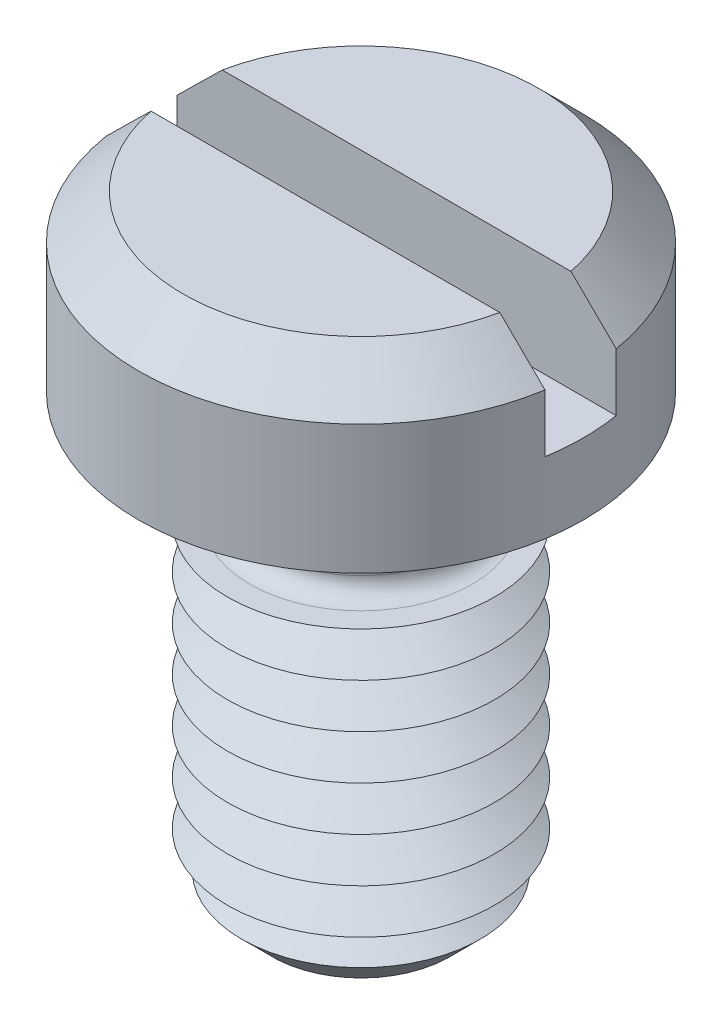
SolidWorks part; units mm, degrees
ref_plane "Front Plane" through (0, 0, 0) normal (0, 0, 1) x (1, 0, 0)
ref_plane "Top Plane" through (0, 0, 0) normal (0, 1, 0) x (1, 0, 0)
ref_plane "Right Plane" through (0, 0, 0) normal (1, 0, 0) x (0, 0, -1)
sketch "Sketch1" plane through (0, 0, 0) normal (0, 1, 0) x (1, 0, 0)
  circle A0 centre (0, 0) radius 5
  dimension "D1" = 10
extrude "Boss-Extrude1" add sketch "Sketch1" along normal blind 3.9
sketch "Sketch2" plane through (0, 0, 0) normal (0, -1, 0) x (1, 0, 0)
  circle A0 centre (0, 0) radius 2.1
  dimension "D1" = 4.2
extrude "Boss-Extrude2" add sketch "Sketch2" along normal blind 10
sketch "Sketch3" plane through (0, -10, 0) normal (0, -1, 0) x (1, 0, 0)
  circle A0 centre (0, 0) radius 3
  dimension "D1" = 6
extrude "Boss-Extrude3" add sketch "Sketch3" against normal blind 7.5
chamfer "Chamfer1" distance 1 angle 45 1 edges at (0, -10, -3)
sketch "Sketch4" plane through (0, 0, 0) normal (1, 0, 0) x (0, 0, -1)
  line L0 (0, -6.5871) -> (0, -12.0372) construction
sketch "Sketch5" plane through (0, 0, 0) normal (1, 0, 0) x (0, 0, -1)
  line L0 (-3, -2.5) -> (-2.134, -3)
  line L1 (-2.134, -3) -> (-3, -3.5)
  line L2 (-3, -2.5) -> (-3, -9) construction
  line L3 (-3, -3.5) -> (-3, -2.5)
  dimension "D1" = 1
revolve "Cut-Revolve1" cut sketch "Sketch5" angle 360 about L0
pattern_linear "LPattern1" count 7 spacing 1 along (0, -1, 0) of "Cut-Revolve1"
fillet "Fillet1" radius 0.4 2 edges at (0, -2.5, -2.1) (0, 0, -2.1)
chamfer "Chamfer2" distance 1 angle 45 1 edges at (0, 3.9, 5)
sketch "Sketch6" plane through (0, 3.9, 0) normal (0, 1, 0) x (1, 0, 0)
  line L1 (5, -0.8) -> (-5, -0.8)
  line L2 (5, -0.8) -> (5, 0.8)
  line L3 (5, 0.8) -> (-5, 0.8)
  line L4 (-5, -0.8) -> (-5, 0.8)
  line L5 (5, -0.8) -> (-5, 0.8) construction
  line L6 (5, 0.8) -> (-5, -0.8) construction
  circle A0 centre (0, 0) radius 5 construction
  point P0 (0, 0)
  dimension "D1" = 1.6
extrude "Cut-Extrude1" cut sketch "Sketch6" against normal blind 2.3
